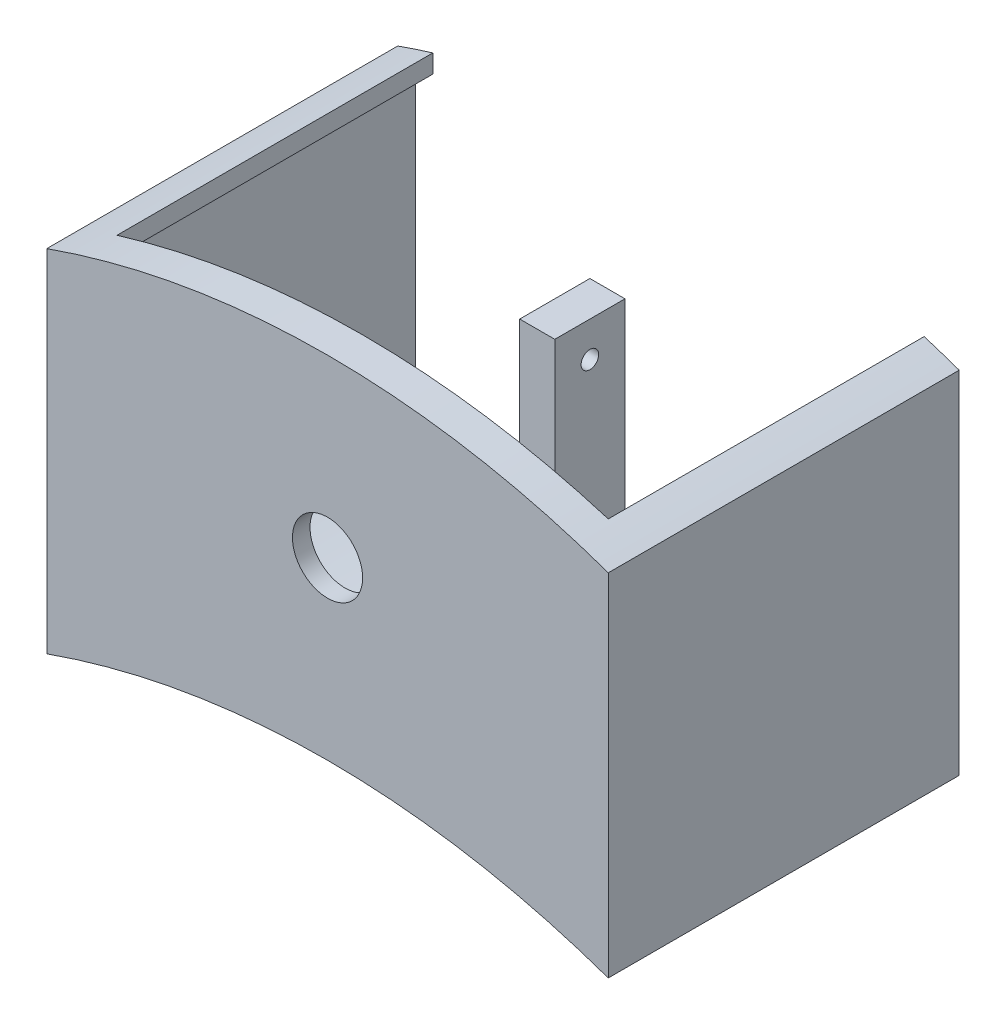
SolidWorks part; units mm, degrees
ref_plane "Front Plane" through (0, 0, 0) normal (0, 0, 1) x (1, 0, 0)
ref_plane "Top Plane" through (0, 0, 0) normal (0, 1, 0) x (1, 0, 0)
ref_plane "Right Plane" through (0, 0, 0) normal (1, 0, 0) x (0, 0, -1)
sketch "Sketch1" plane through (0, 0, 0) normal (0, 0, 1) x (1, 0, 0)
  line L2 (0, 0) -> (0, 31.75)
  line L4 (50.8, 0) -> (50.8, 31.75)
  arc A0 (50.8, 0) -> (0, 0) centre (25.4, -71.842) ccw
  arc A1 (50.8, 31.75) -> (0, 31.75) centre (25.4, -40.092) ccw
  dimension "D1" = 50.8
  dimension "D2" = 31.75
extrude "Extrude1" add sketch "Sketch1" along normal blind 31.75
sketch "Sketch3" plane through (0, 0, 0) normal (0, 0, 1) x (1, 0, 0)
  line L2 (1.5875, 2.211) -> (1.5875, 30.6186)
  line L3 (49.2125, 2.211) -> (49.2125, 30.6186)
  arc A3 (49.2125, 30.6186) -> (1.5875, 30.6186) centre (25.4, -40.092) ccw
  arc A4 (49.2125, 2.211) -> (1.5875, 2.211) centre (25.4, -71.842) ccw
extrude "Extrude2" cut sketch "Sketch3" along normal blind 30.1625
sketch "Sketch4" plane through (0, 0, 31.75) normal (0, 0, 1) x (1, 0, 0)
  line L0 (25.4, 36.108) -> (25.4, 4.358) construction
  arc A0 (50.8, 31.75) -> (0, 31.75) centre (25.4, -40.092) ccw construction
  arc A1 (50.8, 0) -> (0, 0) centre (25.4, -71.842) ccw construction
  circle A2 centre (25.4, 20.233) radius 3.175
extrude "Extrude3" cut sketch "Sketch4" against normal through all
sketch3d "3DSketch1"
  line L0 (50.8, 0, 0) -> (50.8, 31.75, 0) construction
  line L1 (47.625, 28.7582, 0) -> (3.175, 28.7582, 0)
  line L2 (47.625, 28.7582, 0) -> (47.625, 36.9887, 0)
  line L3 (47.625, 36.9887, 0) -> (3.175, 36.9887, 0)
  line L4 (3.175, 28.7582, 0) -> (3.175, 36.9887, 0)
  line L5 (0, 31.75, 0) -> (0, 0, 0) construction
  dimension "D1" = 3.175
  dimension "D2" = 3.175
extrude "Extrude5" cut sketch "3DSketch1" along a picked direction on the side of the normal blind 28.575
sketch "Sketch5" plane through (0, 0, 0) normal (0, 1, 0) x (1, 0, 0)
  line L1 (0, -31.75) -> (0, 0) construction
  line L2 (50.8, 0) -> (0, 0) construction
  line L7 (20.5613, -3.175) -> (23.7363, -3.175)
  line L8 (20.5613, -3.175) -> (20.5613, -9.525)
  line L9 (20.5613, -9.525) -> (23.7363, -9.525)
  line L10 (23.7363, -3.175) -> (23.7363, -9.525)
  dimension "D1" = 3.175
  dimension "D2" = 6.35
  dimension "D3" = 20.5613
  dimension "D4" = 3.175
extrude "Extrude6" add sketch "Sketch5" along normal blind 25.4
sketch "Sketch6" plane through (0, 0, 3.175) normal (0, 0, -1) x (-1, 0, 0)
  line L0 (-20.5613, 4.2042) -> (-20.5613, 0) construction
  line L1 (-20.5613, 4.2042) -> (-20.5613, 0)
  line L2 (-20.5613, 0) -> (-23.7363, 0)
  line L3 (-23.7363, 0) -> (-23.7363, 4.3398)
  arc A0 (-23.7363, 4.3398) -> (-20.5613, 4.2042) centre (-25.4, -71.842) cw
  arc A1 (-20.5613, 4.2042) -> (-23.7363, 4.3398) centre (-25.4, -71.842) ccw construction
extrude "Extrude7" cut sketch "Sketch6" against normal through all
sketch "Sketch7" plane through (23.7363, 0, 0) normal (1, 0, 0) x (0, 0, -1)
  line L0 (-9.525, 25.4) -> (-9.525, 5.9277) construction
  line L1 (-9.525, 25.4) -> (-3.175, 25.4) construction
  circle A0 centre (-6.35, 22.225) radius 0.7937
  dimension "D1" = 3.175
  dimension "D2" = 3.175
extrude "Extrude8" cut sketch "Sketch7" against normal up to next
